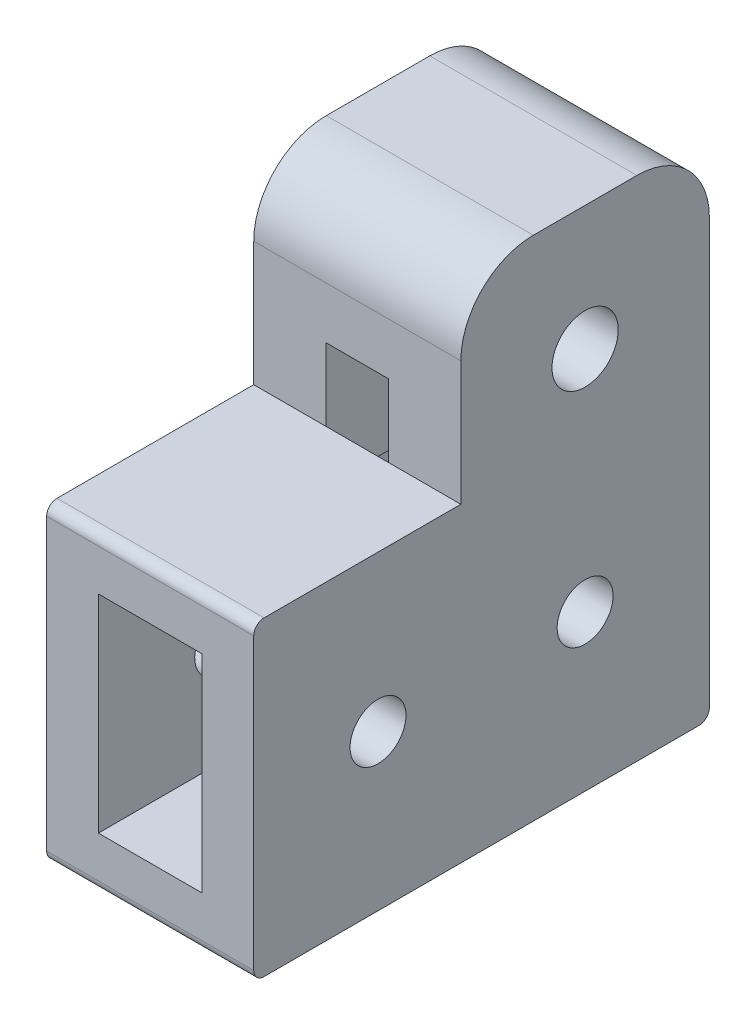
SolidWorks part; units mm, degrees
ref_plane "正面" through (0, 0, 0) normal (1, 0, 0) x (0, 1, 0)
ref_plane "平面" through (0, 0, 0) normal (0, 0, 1) x (0, 1, 0)
ref_plane "右側面" through (0, 0, 0) normal (0, 1, 0) x (-1, 0, 0)
sketch "ｽｹｯﾁ1" plane through (0, 0, 0) normal (1, 0, 0) x (0, 1, 0)
  line L0 (-23, 20) -> (-23, -24)
  line L1 (-23, -24) -> (26, -24)
  line L2 (26, -24) -> (26, 0)
  line L3 (26, 0) -> (7, 0)
  line L4 (7, 0) -> (7, 20)
  line L5 (7, 20) -> (-23, 20)
  circle A0 centre (-8, 8) radius 2.7
  circle A1 centre (-8, -12) radius 2.7
  circle A2 centre (14, -12) radius 3.2
  dimension "D5" = 5.4
  dimension "D6" = 5.4
  dimension "D7" = 6.4
  dimension "D1" = 44
  dimension "D2" = 49
  dimension "D3" = 24
  dimension "D4" = 30
  dimension "D8" = 12
  dimension "D9" = 32
  dimension "D10" = 12
  dimension "D11" = 15
  dimension "D12" = 15
  dimension "D13" = 37
extrude "ﾎﾞｽ - 押し出し1" add sketch "ｽｹｯﾁ1" along normal mid plane 20
sketch "ｽｹｯﾁ2" plane through (0, 0, 0) normal (0, 0, 1) x (1, 0, 0)
  line L0 (10, 7) -> (-10, 7) construction
  line L1 (-3, 14) -> (3, 14)
  line L2 (-3, 14) -> (-3, 7)
  line L3 (-3, 7) -> (3, 7)
  line L4 (3, 14) -> (3, 7)
  line L5 (-3, 14) -> (3, 7) construction
  line L6 (-3, 7) -> (3, 14) construction
  line L7 (-10, 26) -> (-10, 7) construction
  point P0 (0, 10.5)
  dimension "D1" = 7
  dimension "D2" = 6
  dimension "D3" = 10
sketch "ｽｹｯﾁ3" plane through (0, 0, -24) normal (0, 0, -1) x (1, 0, 0)
  line L0 (10, 23) -> (10, -26) construction
  line L1 (-3, 18) -> (3, 18)
  line L2 (-3, 18) -> (-3, -2)
  line L3 (-3, -2) -> (3, -2)
  line L4 (3, 18) -> (3, -2)
  line L5 (-3, 18) -> (3, -2) construction
  line L6 (-3, -2) -> (3, 18) construction
  line L7 (10, 23) -> (-10, 23) construction
  point P0 (0, 8)
  dimension "D1" = 6
  dimension "D2" = 20
  dimension "D3" = 10
  dimension "D4" = 5
loft "ｶｯﾄ - ﾛﾌﾄ1" cut profiles "ｽｹｯﾁ3", "ｽｹｯﾁ2"
fillet "ﾌｨﾚｯﾄ2" radius 7 2 edges at (0, 26, -24) (0, 26, 0)
sketch "ｽｹｯﾁ4" plane through (0, 0, -24) normal (0, 0, -1) x (1, 0, 0)
  line L0 (10, 23) -> (10, -19) construction
  line L1 (-5, 18) -> (5, 18)
  line L2 (-5, 18) -> (-5, -2)
  line L3 (-5, -2) -> (5, -2)
  line L4 (5, 18) -> (5, -2)
  line L5 (-5, 18) -> (5, -2) construction
  line L6 (-5, -2) -> (5, 18) construction
  line L7 (10, 23) -> (-10, 23) construction
  point P0 (0, 8)
  dimension "D1" = 20
  dimension "D2" = 10
  dimension "D3" = 10
  dimension "D4" = 15
extrude "ｶｯﾄ - 押し出し1" cut sketch "ｽｹｯﾁ4" against normal through all
fillet "ﾌｨﾚｯﾄ3" radius 1 3 edges at (0, -23, -24) (0, -23, 20) (0, 7, 20)
